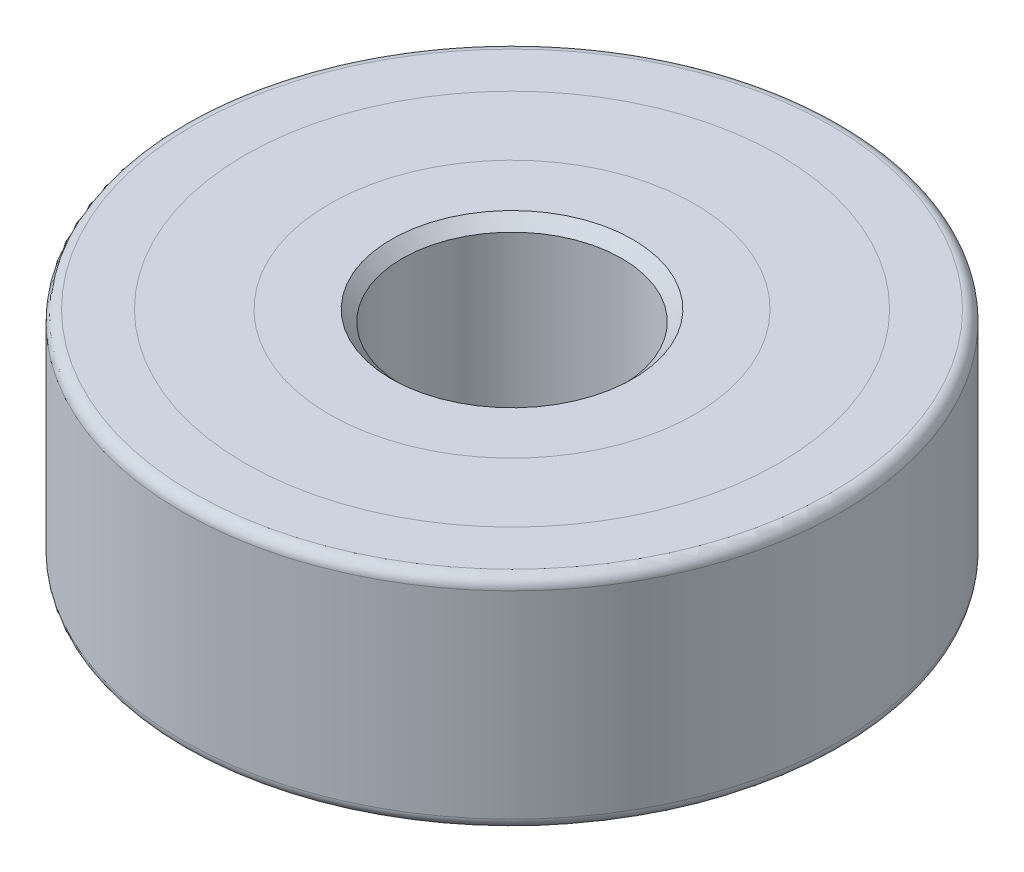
SolidWorks part; units mm, degrees
ref_plane "前视基准面" through (0, 0, 0) normal (0, 0, 1) x (1, 0, 0)
ref_plane "上视基准面" through (0, 0, 0) normal (0, 1, 0) x (1, 0, 0)
ref_plane "右视基准面" through (0, 0, 0) normal (1, 0, 0) x (0, 0, -1)
sketch "草图1" plane through (0, 0, 0) normal (0, 1, 0) x (1, 0, 0)
  circle A0 centre (0, 0) radius 15
  circle A1 centre (0, 0) radius 5
extrude "凸台-拉伸1" add sketch "草图1" along normal blind 10
sketch "草图2" plane through (0, 10, 0) normal (0, 1, 0) x (1, 0, 0)
  circle A0 centre (0, 0) radius 8.3063
  circle A1 centre (0, 0) radius 12.152
split "分割1" trim tools "草图2" bodies to split 106 resulting bodies 107 108 109
chamfer "倒角1" distance 0.5 angle 45 2 edges at (0, 0, 5) (0, 10, 5)
fillet "圆角1" radius 0.5 2 edges at (0, 0, 15) (0, 10, 15)
